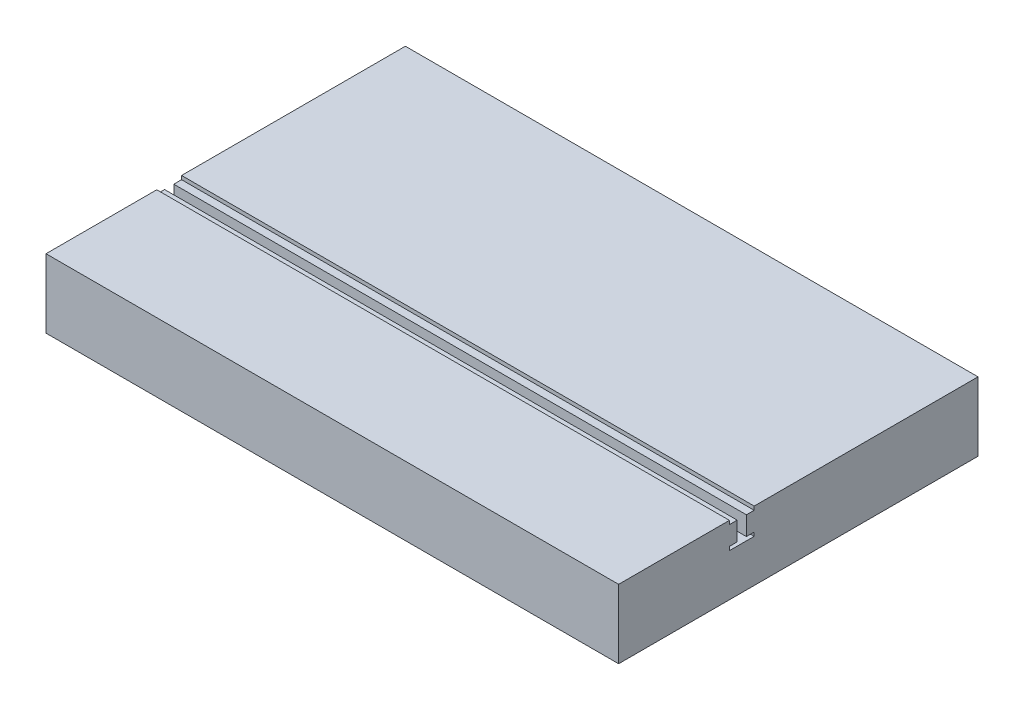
SolidWorks part; units mm, degrees
ref_plane "Front Plane" through (0, 0, 0) normal (0, 0, 1) x (1, 0, 0)
ref_plane "Top Plane" through (0, 0, 0) normal (0, 1, 0) x (1, 0, 0)
ref_plane "Right Plane" through (0, 0, 0) normal (1, 0, 0) x (0, 0, -1)
sketch "Sketch1" plane through (0, 0, 0) normal (0, 1, 0) x (1, 0, 0)
  line L0 (99.8579, -62.6713) -> (-99.8579, 62.6713) construction
  line L1 (-99.8579, 62.6713) -> (99.8579, 62.6713)
  line L2 (-99.8579, 62.6713) -> (-99.8579, -62.6713)
  line L3 (-99.8579, -62.6713) -> (99.8579, -62.6713)
  line L4 (99.8579, 62.6713) -> (99.8579, -62.6713)
extrude "Extrude1" add sketch "Sketch1" along normal blind 24
sketch "Sketch2" plane through (99.8579, 0, 0) normal (1, 0, 0) x (0, 0, -1)
  line L0 (-19.7115, 30.0759) -> (-19.7115, 5.3859) construction
  line L1 (-24.0336, 24) -> (-15.3895, 24)
  line L2 (-62.6713, 24) -> (62.6713, 24) construction
  line L4 (-15.3895, 24) -> (-15.3895, 22.715)
  line L5 (-24.0336, 24) -> (-24.0336, 22.715)
  line L6 (-15.3895, 22.715) -> (-18.0973, 22.715)
  line L7 (-24.0336, 22.715) -> (-21.3258, 22.715)
  line L8 (-18.0973, 22.715) -> (-18.0973, 16.1307)
  line L9 (-21.3258, 22.715) -> (-21.3258, 16.1307)
  line L10 (-18.0973, 16.1307) -> (-15.3895, 16.1307)
  line L11 (-21.3258, 16.1307) -> (-24.0336, 16.1307)
  line L12 (-15.3895, 16.1307) -> (-15.3895, 14.8457)
  line L13 (-24.0336, 16.1307) -> (-24.0336, 14.8457)
  line L14 (-15.3895, 14.8457) -> (-24.0336, 14.8457)
  point P18 (-19.7115, 14.8457)
extrude "Cut-Extrude1" cut sketch "Sketch2" against normal through all
